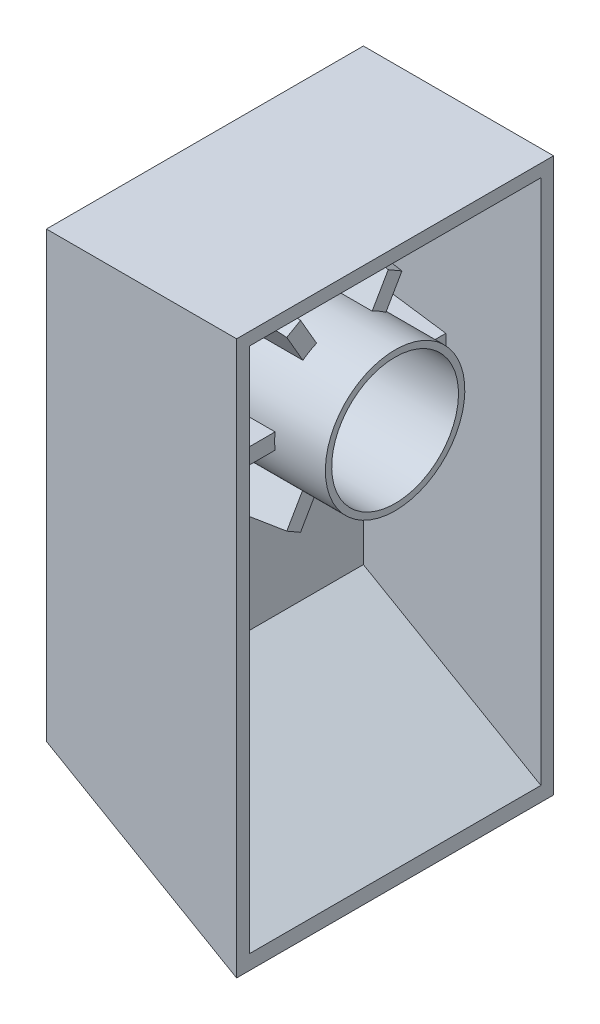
SolidWorks part; units mm, degrees
ref_plane "Płaszczyzna przednia" through (0, 0, 0) normal (0, 0, 1) x (1, 0, 0)
ref_plane "Płaszczyzna górna" through (0, 0, 0) normal (0, 1, 0) x (1, 0, 0)
ref_plane "Płaszczyzna prawa" through (0, 0, 0) normal (1, 0, 0) x (0, 0, -1)
sketch "Szkic1" plane through (0, 0, 0) normal (0, 0, 1) x (1, 0, 0)
  line L0 (0, 0) -> (0, 140)
  line L1 (0, 140) -> (60, 140)
  line L2 (60, 140) -> (60, -34.641)
  line L3 (60, -34.641) -> (0, 0)
  dimension "D1" = 140
  dimension "D2" = 60
  dimension "D3" = 120
extrude "Dodanie-wyciągnięcie1" add sketch "Szkic1" along normal mid plane 100
sketch "Szkic2" plane through (60, 0, 0) normal (1, 0, 0) x (0, 0, -1)
  line L0 (-50, 140) -> (50, 140) construction
  circle A0 centre (0, 90) radius 20
  dimension "D1" = 40
  dimension "D2" = 50
extrude "Wytnij-wyciągnięcie1" cut sketch "Szkic2" against normal through all
shell "Skorupa1" thickness 4
ref_plane "Płaszczyzna1" through (0, 90, 0) normal (0, 1, 0) x (1, 0, 0)
sketch "Szkic3" plane through (0, 90, 0) normal (0, 1, 0) x (1, 0, 0)
  line L0 (44, 22) -> (44, 32)
  line L1 (60, 22) -> (4, 22) construction
  line L2 (44, 32) -> (4, 37)
  line L3 (60, 22) -> (4, 22) construction
  line L4 (4, -46) -> (4, 46) construction
  dimension "D1" = 10
  dimension "D2" = 15
  dimension "D3" = 40
rib "Żebro1" sketch "Szkic3" sketch "Szkic3" thickness 5 extrusion direction parallel to sketch draft on no parameters "D1"=5
pattern_circular "Szyk kołowy1" count 6 over 360 about axis through (0, 90, 0) along (1, 0, 0) of "Żebro1"
